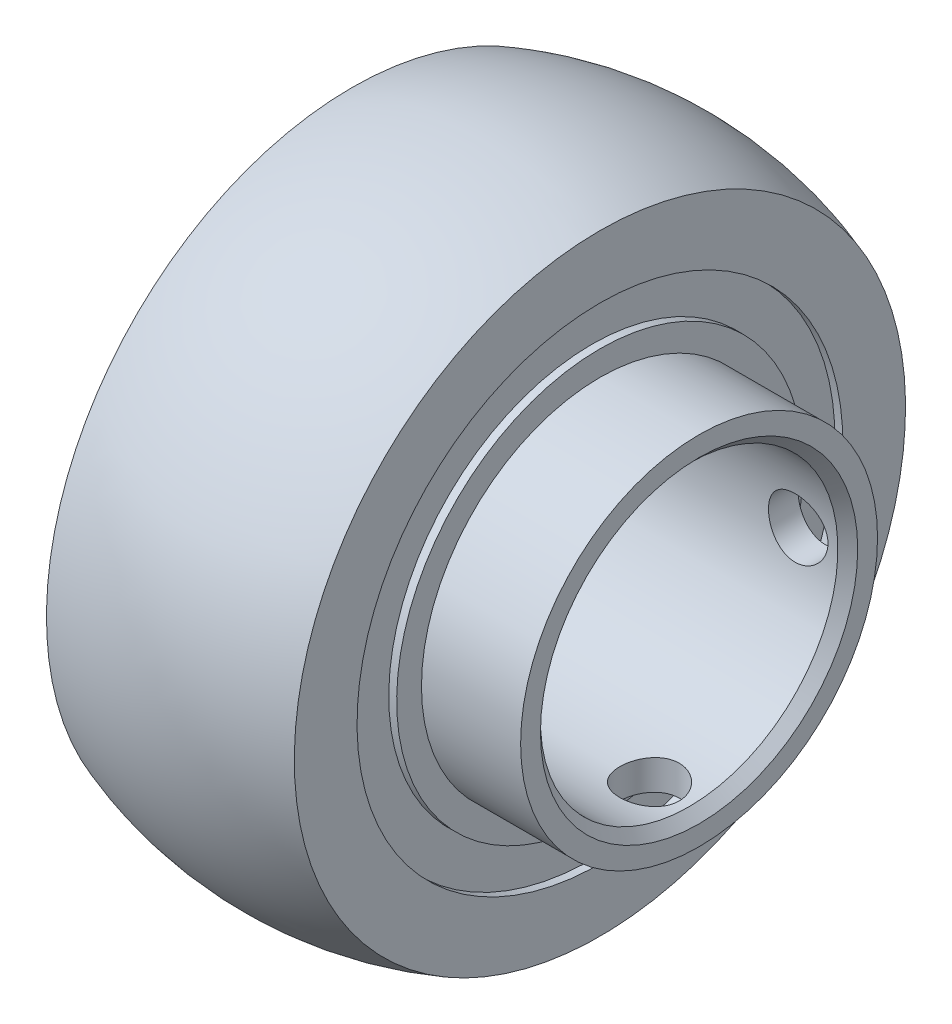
SolidWorks part; units mm, degrees
ref_plane "Plan1" through (0, 0, 0) normal (0, 0, 1) x (1, 0, 0)
ref_plane "Plan2" through (0, 0, 0) normal (0, 1, 0) x (1, 0, 0)
ref_plane "Plan3" through (0, 0, 0) normal (1, 0, 0) x (0, 0, -1)
sketch "Esquisse3" plane through (0, 0, 0) normal (0, 0, 1) x (1, 0, 0)
  line L0 (13, 0) -> (-13, 0) construction
  line L1 (21.5, 15) -> (-16.5, 15)
  line L2 (-12.5, 18) -> (-12.5, 20.5)
  line L3 (22.5, 16) -> (22.5, 18)
  line L4 (22.5, 18) -> (12.5, 18)
  line L5 (12.5, 18) -> (12.5, 20.5)
  line L6 (-12.5, 24.5) -> (-11.7, 24.5)
  line L7 (22.5, 16) -> (21.5, 15)
  line L8 (-12.5, 18) -> (-17.5, 18)
  line L9 (-17.5, 18) -> (-17.5, 16)
  line L10 (-17.5, 16) -> (-16.5, 15)
  line L11 (-11.7, 24.5) -> (-11.7, 20.5)
  line L12 (-11.7, 20.5) -> (-12.5, 20.5)
  line L13 (12.5, 24.5) -> (11.7, 24.5)
  line L14 (11.7, 24.5) -> (11.7, 20.5)
  line L15 (11.7, 20.5) -> (12.5, 20.5)
  line L16 (12.5, 24.5) -> (12.5, 30.8246)
  line L17 (-12.5, 24.5) -> (-12.5, 30.8246)
  arc A0 (12.5, 30.8246) -> (-12.5, 30.8246) centre (0, -4) ccw
  dimension "D5" = 37
  dimension "D1" = 5
  dimension "D2" = 25
  dimension "D3" = 15
  dimension "D4" = 18
  dimension "D6" = 12.5
  dimension "D7" = 1
  dimension "D8" = 1
  dimension "D9" = 1
  dimension "D10" = 1
  dimension "D11" = 10
  dimension "D12" = 0.8
  dimension "D13" = 0.8
  dimension "D14" = 4
  dimension "D15" = 2.5
  dimension "D16" = 30.8246
revolve "Base-Révolution" add sketch "Esquisse3" angle 360 about L0
sketch "Esquisse4" plane through (0, 0, 0) normal (0, 0, 1) x (1, 0, 0)
  line L0 (13, 0) -> (-13, 0) construction
  line L1 (22.5, -18) -> (22.5, 18) construction
  circle A0 centre (17.5, 0) radius 3
  dimension "D1" = 6
  dimension "D2" = 5
extrude "Enlèv. mat.-Extru.4" cut sketch "Esquisse4" against normal blind 40
sketch "Esquisse5" plane through (0, 0, 0) normal (0, 1, 0) x (1, 0, 0)
  line L0 (17.5, 18) -> (17.5, 15) construction
  line L1 (13, 0) -> (-13, 0) construction
  circle A0 centre (17.5, 0) radius 3
  dimension "D1" = 6
extrude "Enlèv. mat.-Extru.5" cut sketch "Esquisse5" against normal blind 40
